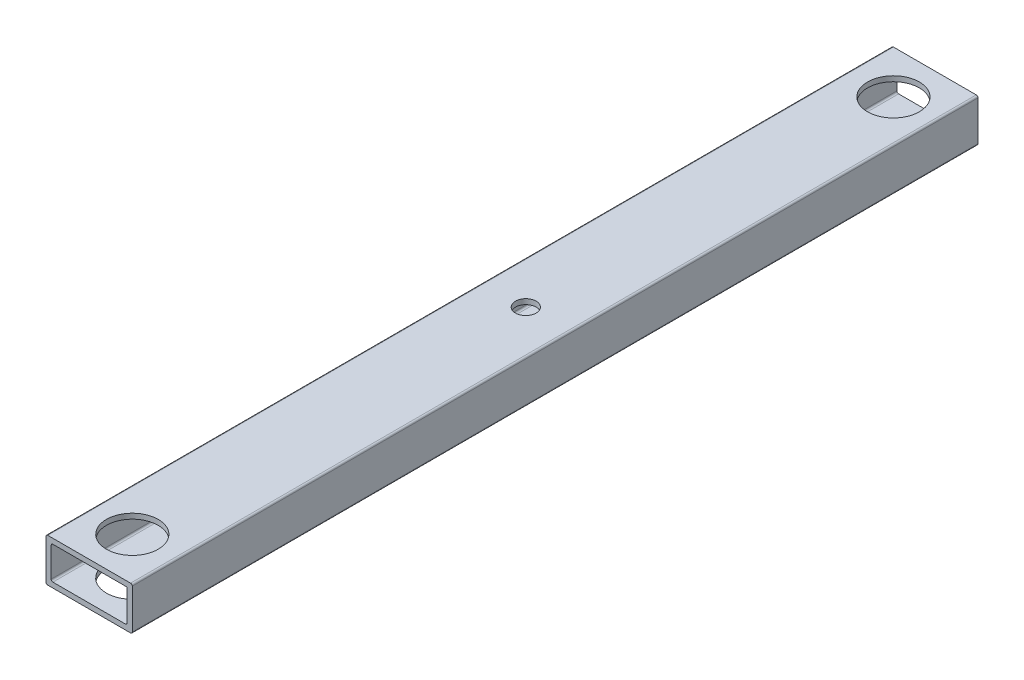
SolidWorks part; units mm, degrees
ref_plane "Plan de face" through (0, 0, 0) normal (0, 0, 1) x (1, 0, 0)
ref_plane "Plan de dessus" through (0, 0, 0) normal (0, 1, 0) x (1, 0, 0)
ref_plane "Plan de droite" through (0, 0, 0) normal (1, 0, 0) x (0, 0, -1)
sketch "Esquisse1" plane through (0, 0, 0) normal (0, 0, 1) x (1, 0, 0)
  line L0 (3, 4) -> (3, 21)
  line L1 (1, 0) -> (49, 0)
  line L2 (0, 1) -> (0, 24)
  line L3 (1, 25) -> (49, 25)
  line L4 (50, 1) -> (50, 24)
  line L5 (4, 22) -> (47, 22)
  line L6 (47, 4) -> (47, 22)
  line L7 (4, 3) -> (46, 3)
  line L8 (3, 3) -> (3, 22) construction
  line L9 (3, 22) -> (47, 22) construction
  line L10 (0, 0) -> (0, 25) construction
  line L11 (0, 25) -> (50, 25) construction
  line L12 (50, 0) -> (50, 25) construction
  line L13 (0, 0) -> (50, 0) construction
  line L14 (47, 3) -> (47, 22) construction
  line L15 (3, 3) -> (47, 3) construction
  arc A0 (3, 21) -> (4, 22) centre (4, 21) cw
  arc A1 (0, 24) -> (1, 25) centre (1, 24) cw
  arc A2 (50, 24) -> (49, 25) centre (49, 24) ccw
  arc A3 (49, 0) -> (50, 1) centre (49, 1) ccw
  arc A4 (47, 4) -> (46, 3) centre (46, 4) cw
  arc A5 (4, 3) -> (3, 4) centre (4, 4) cw
  arc A6 (1, 0) -> (0, 1) centre (1, 1) cw
  dimension "D4" = 1
  dimension "D1" = 50
  dimension "D2" = 25
  dimension "D3" = 3
extrude "Extrusion1" add sketch "Esquisse1" along normal blind 490
sketch "Esquisse2" plane through (0, 25, 0) normal (0, 1, 0) x (-1, 0, 0)
  line L0 (-49, 0) -> (-1, 0) construction
  circle A0 centre (-26, 25) radius 15
  circle A1 centre (-25, 237) radius 6
  circle A2 centre (-25, 465) radius 15
  dimension "D1" = 30
  dimension "D2" = 25
  dimension "D3" = 25
  dimension "D4" = 30
  dimension "D5" = 25
  dimension "D6" = 440
  dimension "D7" = 12
  dimension "D8" = 212
  dimension "D9" = 25
extrude "Enlèv. mat.-Extru.1" cut sketch "Esquisse2" against normal through all
